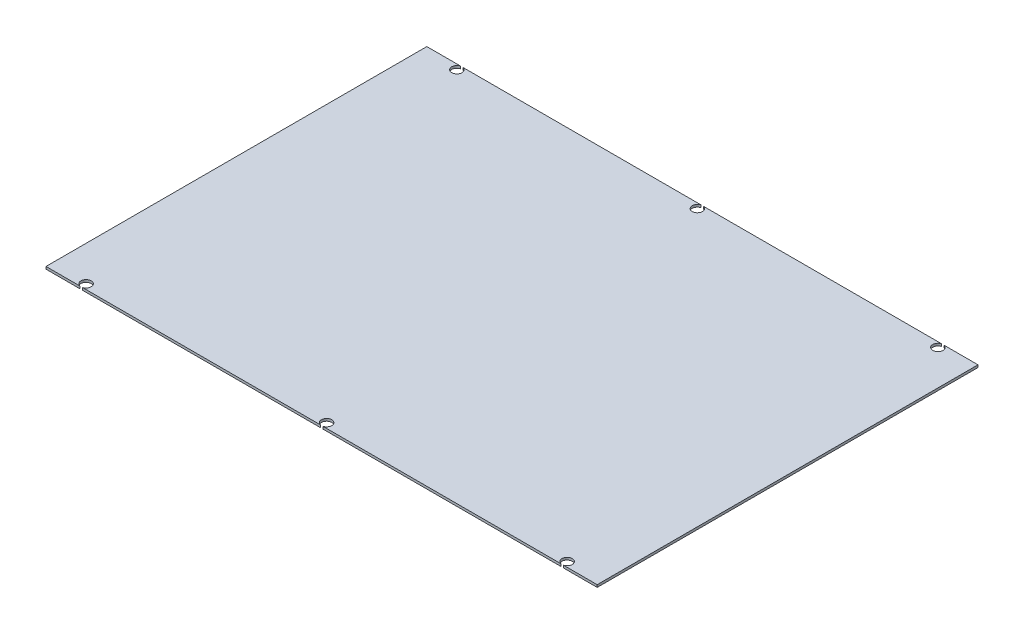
SolidWorks part; units mm, degrees
ref_plane "Front Plane" through (0, 0, 0) normal (0, 0, 1) x (1, 0, 0)
ref_plane "Top Plane" through (0, 0, 0) normal (0, 1, 0) x (1, 0, 0)
ref_plane "Right Plane" through (0, 0, 0) normal (1, 0, 0) x (0, 0, -1)
sketch "Sketch1" plane through (0, 0, 0) normal (0, 1, 0) x (1, 0, 0)
  line L1 (0, 0) -> (174.625, 0)
  line L2 (0, 0) -> (0, 120.65)
  line L3 (0, 120.65) -> (174.625, 120.65)
  line L4 (174.625, 0) -> (174.625, 120.65)
  dimension "D1" = 174.625
  dimension "D2" = 120.65
extrude "Extrude1" add sketch "Sketch1" along normal blind 0.762
hole_wizard "#4 Clearance Hole1" positions "Sketch3" profile "Sketch2" hole size "#4" standard "Ansi Inch"
sketch "Sketch3" plane through (0, 0.762, 0) normal (0, 1, 0) x (-1, 0, 0)
  line L0 (-11.1125, -1.5875) -> (0, -1.5875) construction
  line L1 (0, -120.65) -> (0, 0) construction
  line L4 (-163.5125, -1.5875) -> (-174.625, -1.5875) construction
  line L5 (-174.625, 0) -> (-174.625, -120.65) construction
  line L8 (0, 0) -> (-174.625, 0) construction
  line L9 (0, -60.325) -> (-174.625, -60.325) construction
  line L10 (-163.5125, -119.0625) -> (-174.625, -119.0625) construction
  line L11 (-11.1125, -119.0625) -> (0, -119.0625) construction
  point P5 (-11.1125, -1.5875)
  point P7 (-87.3125, -1.5875)
  point P9 (-163.5125, -1.5875)
  point P38 (-87.3125, -119.0625)
  point P39 (-163.5125, -119.0625)
  point P41 (-11.1125, -119.0625)
  dimension "D1" = 76.2
  dimension "D2" = 76.2
  dimension "D3" = 1.5875
sketch "Sketch2" plane through (11.1125, 0.762, -1.5875) normal (1, 0, 0) x (0, 0, 1)
  line L0 (0, 0) -> (0, 4.2826)
  line L1 (0, 4.2826) -> (1.6319, 3.302)
  line L2 (1.6319, 3.302) -> (1.6319, 0)
  line L5 (1.6319, 0) -> (0, 0)
  line L10 (0, 4.2826) -> (-1.632, 3.302) construction
  line L11 (0, -6.35) -> (0, 107.95) construction
  dimension "Hole Dia." = 3.2639
  dimension "Hole Depth" = 3.302
  dimension "Drill Angle" = 118
